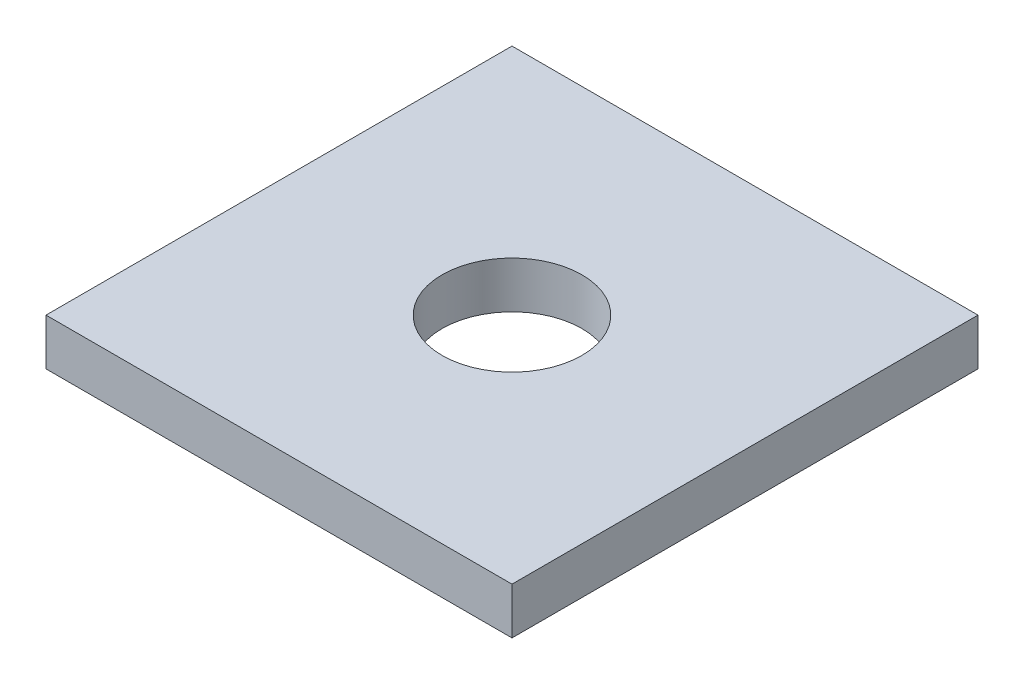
SolidWorks part; units mm, degrees
ref_plane "Front Plane" through (0, 0, 0) normal (0, 0, 1) x (1, 0, 0)
ref_plane "Top Plane" through (0, 0, 0) normal (0, 1, 0) x (1, 0, 0)
ref_plane "Right Plane" through (0, 0, 0) normal (1, 0, 0) x (0, 0, -1)
sketch "Sketch1" plane through (0, 0, 0) normal (0, 1, 0) x (1, 0, 0)
  line L0 (30, 30) -> (0, 0) construction
  line L1 (0, 0) -> (30, 0)
  line L2 (0, 0) -> (0, 30)
  line L3 (0, 30) -> (30, 30)
  line L4 (30, 0) -> (30, 30)
  circle A0 centre (15, 15) radius 4.5
  dimension "D2" = 9
  dimension "D1" = 30
extrude "Extrude1" add sketch "Sketch1" along normal blind 3
